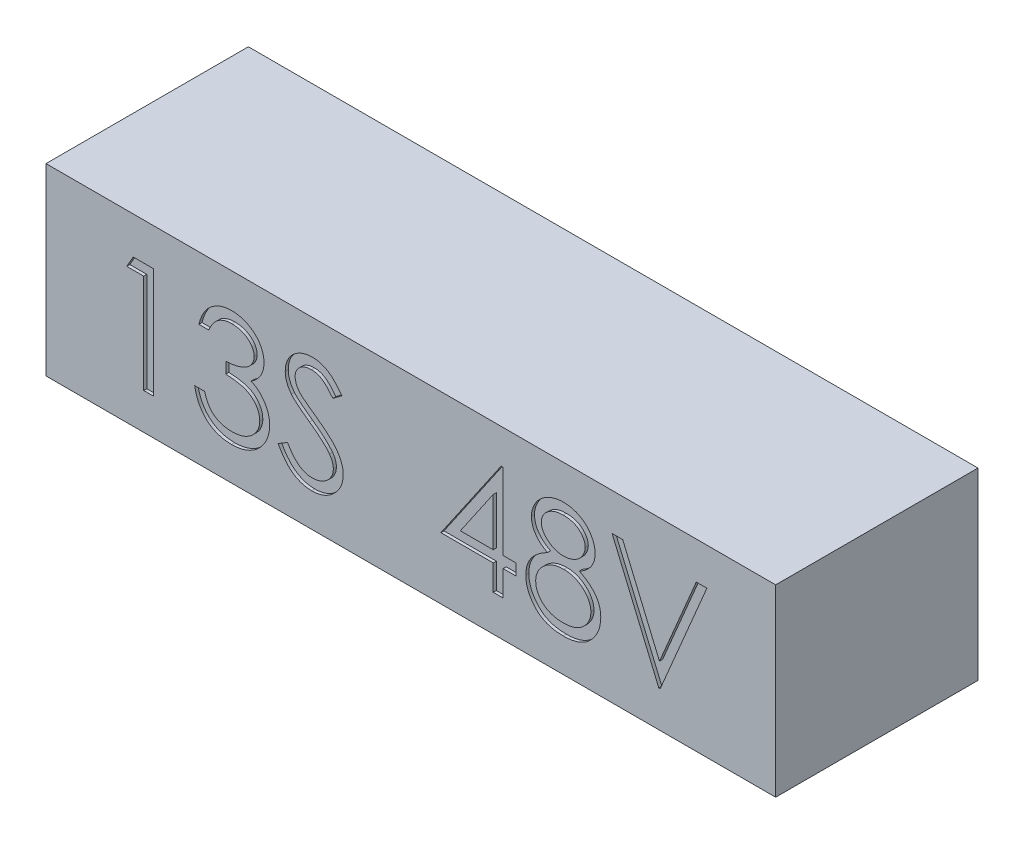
SolidWorks part; units mm, degrees
ref_plane "Plan de face" through (0, 0, 0) normal (0, 0, 1) x (1, 0, 0)
ref_plane "Plan de dessus" through (0, 0, 0) normal (0, 1, 0) x (1, 0, 0)
ref_plane "Plan de droite" through (0, 0, 0) normal (1, 0, 0) x (0, 0, -1)
sketch "Esquisse1" plane through (0, 0, 0) normal (0, 0, 1) x (1, 0, 0)
  line L0 (-119, 30) -> (119, 30)
  line L1 (-119, 30) -> (-119, -30)
  line L2 (119, 30) -> (119, -30)
  line L3 (-119, -30) -> (119, -30)
  line L4 (-119, 30) -> (119, -30) construction
  dimension "D1" = 60
  dimension "D2" = 238
extrude "Boss.-Extru.1" add sketch "Esquisse1" along normal mid plane 66
sketch "Esquisse2" plane through (0, 0, 33) normal (0, 0, 1) x (1, 0, 0)
  line L0 (-99.5835, -18.162) -> (96.2978, -18.162) construction
  text T0 "13S  48V" font "Century Gothic" height 36
extrude "Enlèv. mat.-Extru.1" cut sketch "Esquisse2" against normal blind 1
